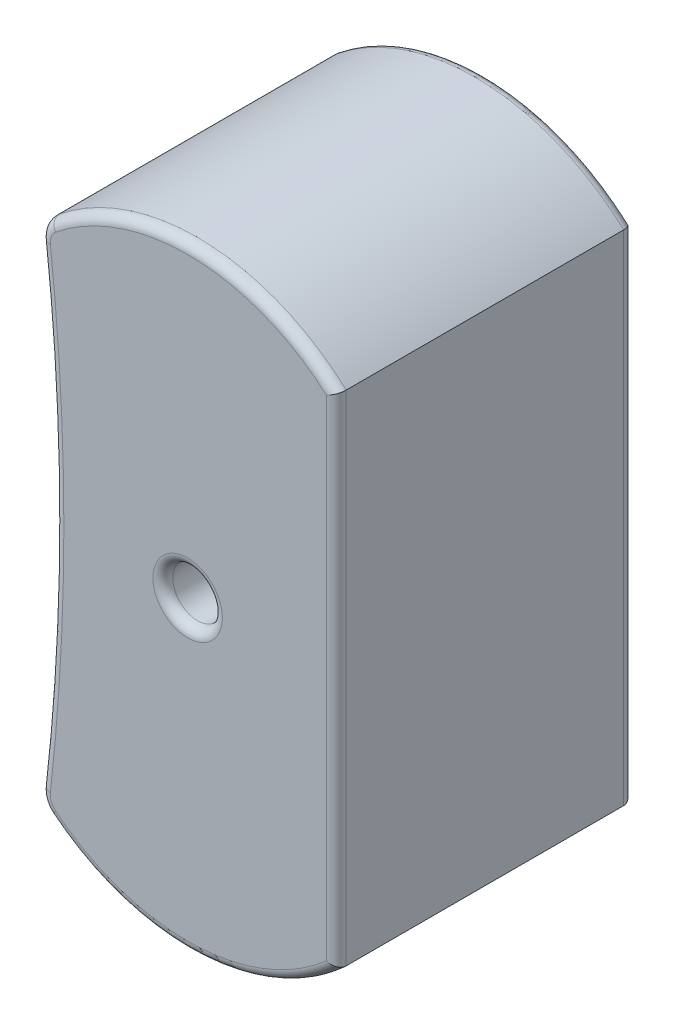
SolidWorks part; units mm, degrees
ref_plane "Plan de face" through (0, 0, 0) normal (0, 0, 1) x (1, 0, 0)
ref_plane "Plan de dessus" through (0, 0, 0) normal (0, 1, 0) x (1, 0, 0)
ref_plane "Plan de droite" through (0, 0, 0) normal (1, 0, 0) x (0, 0, -1)
sketch "Esquisse1" plane through (0, 0, 0) normal (0, 0, 1) x (1, 0, 0)
  line L4 (12, 2.3365) -> (12, 22.4635)
  arc A0 (0.4268, 22.831) -> (12, 22.4635) centre (6, 15.9281) cw
  arc A1 (0.4268, 1.969) -> (12, 2.3365) centre (6, 8.8719) ccw
  arc A2 (0.0614, 21.9396) -> (0.0614, 2.8604) centre (-83.5598, 12.4) cw
  arc A3 (0.0614, 21.9396) -> (0.4268, 22.831) centre (1.055, 22.0529) cw
  arc A4 (0.4268, 1.969) -> (0.0614, 2.8604) centre (1.055, 2.7471) cw
  circle A5 centre (6, 12.4) radius 1
  dimension "D1" = 1
extrude "Extrusion1" add sketch "Esquisse1" along normal blind 12
fillet "Congé1" radius 0.4 7 edges at (7, 12.4, 12) (6.2816, 24.7955, 12) (12, 12.4, 12) (6.2816, 0.0045, 12) (0.1297, 2.3678, 12) (0.6038, 12.4, 12) (0.1297, 22.4322, 12)
fillet "Congé2" radius 0.4 7 edges at (7, 12.4, 0) (0.6038, 12.4, 0) (0.1297, 2.3678, 0) (6.2816, 0.0045, 0) (12, 12.4, 0) (6.2816, 24.7955, 0) (0.1297, 22.4322, 0)
